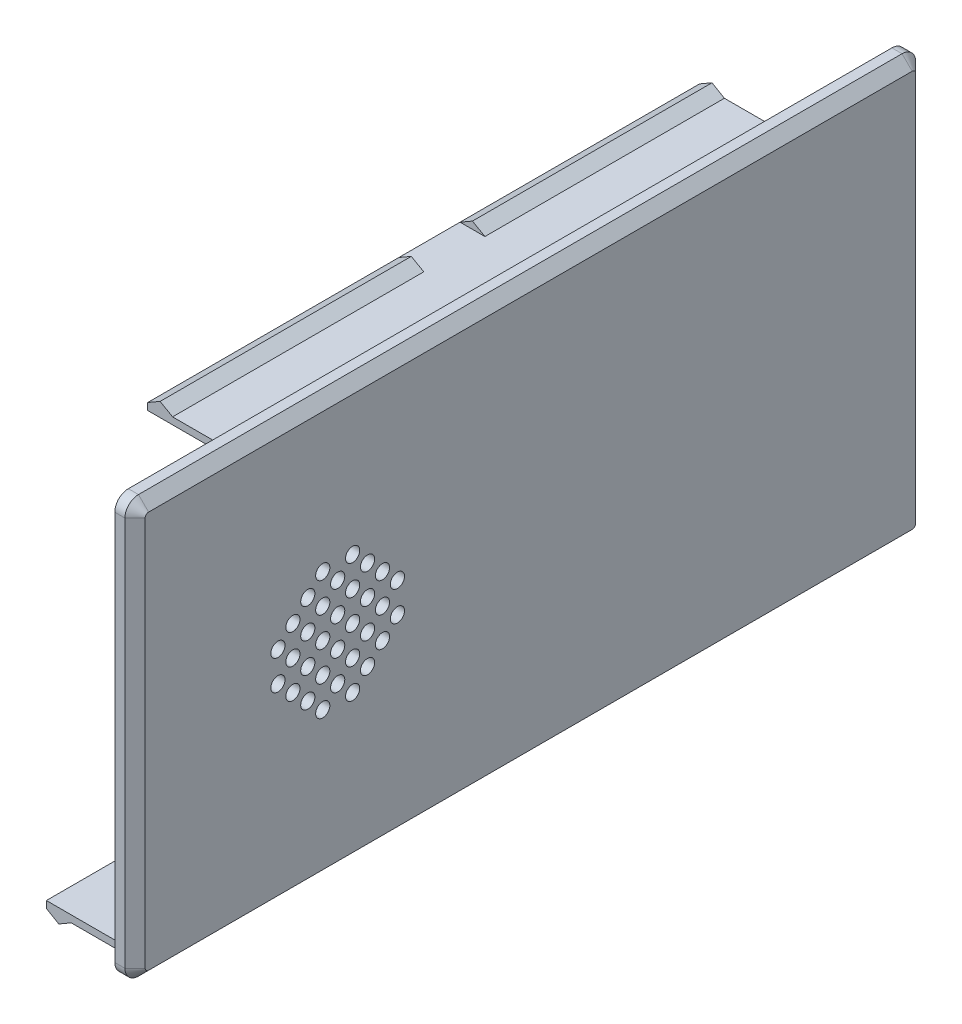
SolidWorks part; units mm, degrees
ref_plane "Front Plane" through (0, 0, 0) normal (0, 0, 1) x (1, 0, 0)
ref_plane "Top Plane" through (0, 0, 0) normal (0, 1, 0) x (1, 0, 0)
ref_plane "Right Plane" through (0, 0, 0) normal (1, 0, 0) x (0, 0, -1)
sketch "Sketch2" plane through (0, 0, 0) normal (1, 0, 0) x (0, 0, -1)
  line L0 (99.1126, 50.58) -> (99.1126, 1.7) construction
  line L1 (0, 0) -> (99.1126, 0)
  line L2 (0, 0) -> (0, 52.28)
  line L3 (0, 52.28) -> (99.1126, 52.28)
  line L4 (99.1126, 0) -> (99.1126, 52.28)
  line L5 (-67.31, 52.28) -> (97.4126, 52.28) construction
extrude "Boss-Extrude1" add sketch "Sketch2" along normal blind 2.54
sketch "Sketch3" plane through (0, 0, 0) normal (-1, 0, 0) x (0, 0, 1)
  line L0 (67.31, 50.58) -> (-97.4126, 50.58) construction
  line L1 (-1.42, 50.43) -> (-97.2626, 50.43)
  line L2 (-1.42, 50.43) -> (-1.42, 1.85)
  line L3 (-1.42, 1.85) -> (-97.2626, 1.85)
  line L4 (-97.2626, 50.43) -> (-97.2626, 1.85)
  line L5 (-97.4126, 1.7) -> (-1.27, 1.7) construction
  line L6 (-97.4126, 50.58) -> (-97.4126, 1.7) construction
  line L7 (-1.27, 1.7) -> (-1.27, 47.405) construction
  dimension "D1" = 0.15
  dimension "D2" = 0.15
  dimension "D3" = 0.15
  dimension "D4" = 0.15
extrude "Extrude-Thin1" add sketch "Sketch3" along normal blind 0.762 thin
sketch "Sketch4" plane through (0, 0, -1.42) normal (0, 0, 1) x (1, 0, 0)
  line L0 (-0.762, 50.43) -> (-6.8767, 50.43)
  line L1 (-6.8767, 50.43) -> (-8.4356, 51.33)
  line L2 (-8.4356, 51.33) -> (-9.9944, 50.43)
  line L3 (-9.9944, 50.43) -> (-9.9944, 49.56)
  line L4 (-9.9944, 49.56) -> (-0.762, 49.56)
  line L5 (-0.762, 1.85) -> (-0.762, 50.43) construction
  line L6 (-0.762, 49.56) -> (-0.762, 50.43)
  line L7 (-6.8767, 50.43) -> (-9.9944, 50.43) construction
  point P3 (-8.4356, 50.43)
  dimension "D1" = 6.1147
  dimension "D2" = 0.9
  dimension "D3" = 120
extrude "Boss-Extrude2" add sketch "Sketch4" against normal up to surface (95.8426 mm away)
ref_plane "Plane1" through (0, 26.14, 0) normal (0, 1, 0) x (1, 0, 0)
fillet "Fillet1" radius 1.7 4 edges at (1.27, 52.28, 0) (1.27, 0, 0) (1.27, 52.28, -99.1126) (1.27, 0, -99.1126)
sketch "Sketch5" plane through (0, 50.43, 0) normal (0, 1, 0) x (1, 0, 0)
  line L0 (-9.9944, 97.2626) -> (-9.9944, 1.42) construction
  line L1 (-9.9944, 45.6048) -> (-6.1087, 45.6048)
  line L2 (-9.9944, 45.6048) -> (-9.9944, 53.2701)
  line L3 (-9.9944, 53.2701) -> (-6.1087, 53.2701)
  line L4 (-6.1087, 45.6048) -> (-6.1087, 53.2701)
  line L5 (0, 99.1126) -> (2.54, 99.1126) construction
  dimension "D1" = 45.8425
  dimension "D2" = 7.6654
  dimension "D3" = 3.8857
extrude "Cut-Extrude1" cut sketch "Sketch5" along normal through all
mirror "Mirror3" about plane through (0, 26.14, 0) normal (0, 1, 0) of "Cut-Extrude1", "Boss-Extrude2"
sketch "Sketch6" plane through (0, 50.43, 0) normal (0, 1, 0) x (1, 0, 0)
  line L1 (-0.762, 83.2926) -> (-9.9944, 83.2926)
  line L2 (-0.762, 83.2926) -> (-0.762, 97.2626)
  line L3 (-0.762, 97.2626) -> (-9.9944, 97.2626)
  line L4 (-9.9944, 83.2926) -> (-9.9944, 97.2626)
  dimension "D1" = 13.97
extrude "Cut-Extrude2" cut sketch "Sketch6" against normal through all and the other way through all
chamfer "Chamfer1" distance 1.27 angle 45 8 edges at (2.54, 0, -49.5563) (2.54, 0.4979, -98.6147) (2.54, 0.4979, -0.4979) (2.54, 26.14, -99.1126) (2.54, 26.14, 0) (2.54, 51.7821, -98.6147) (2.54, 51.7821, -0.4979) (2.54, 52.28, -49.5563)
sketch "Sketch7" plane through (0, 50.43, 0) normal (0, 1, 0) x (1, 0, 0)
  line L0 (-6.8767, 1.42) -> (0, 1.42) construction
  line L1 (-0.762, 1.42) -> (-9.9944, 1.42)
  line L2 (-0.762, 1.42) -> (-0.762, 14.12)
  line L3 (-0.762, 14.12) -> (-9.9944, 14.12)
  line L4 (-9.9944, 1.42) -> (-9.9944, 14.12)
  line L5 (-9.9944, 45.6048) -> (-9.9944, 1.42) construction
  line L6 (-0.762, 2.29) -> (-0.762, 1.42) construction
  dimension "D1" = 12.7
extrude "Cut-Extrude3" cut sketch "Sketch7" against normal up to next and the other way up to next
sketch "Sketch8" plane through (2.54, 0, 0) normal (1, 0, 0) x (0, 0, -1)
  line L0 (0.6985, 26.14) -> (-0.6985, 26.14) construction
  line L1 (34.7621, 29.8848) -> (34.7621, 33.6297) construction
  line L2 (0, 1.7) -> (0, 50.58) construction
  line L3 (34.7621, 33.6297) -> (32.8897, 33.6297) construction
  line L4 (32.8897, 33.6297) -> (32.8897, 35.5021) construction
  line L5 (34.7621, 33.6297) -> (32.8897, 35.5021) construction
  line L6 (32.8897, 33.6297) -> (31.0173, 33.6297) construction
  line L7 (31.0173, 33.6297) -> (32.8897, 35.5021) construction
  line L8 (34.7621, 33.6297) -> (32.8897, 31.7573) construction
  line L9 (32.8897, 31.7573) -> (32.8897, 33.6297) construction
  line L10 (32.8897, 31.7573) -> (31.0173, 33.6297) construction
  line L15 (14.1655, 35.5021) -> (32.8897, 35.5021) construction
  circle A0 centre (25.4, 26.14) radius 9.525 construction
  circle A1 centre (32.8897, 35.5021) radius 0.889 construction
  circle A2 centre (34.7621, 33.6297) radius 0.889 construction
  circle A3 centre (31.0173, 33.6297) radius 0.889 construction
  circle A4 centre (32.8897, 31.7573) radius 0.889 construction
  circle A5 centre (29.1448, 35.5021) radius 0.889 construction
  circle A6 centre (31.0173, 33.6297) radius 0.889 construction
  circle A7 centre (25.4, 35.5021) radius 0.889 construction
  circle A8 centre (27.2724, 33.6297) radius 0.889
  circle A9 centre (21.6552, 35.5021) radius 0.889 construction
  circle A10 centre (23.5276, 33.6297) radius 0.889
  circle A11 centre (17.9103, 35.5021) radius 0.889 construction
  circle A12 centre (19.7827, 33.6297) radius 0.889 construction
  circle A13 centre (14.1655, 35.5021) radius 0.889 construction
  circle A14 centre (16.0379, 33.6297) radius 0.889 construction
  circle A17 centre (29.1448, 31.7573) radius 0.889
  circle A18 centre (31.0173, 29.8848) radius 0.889
  circle A19 centre (25.4, 31.7573) radius 0.889
  circle A20 centre (27.2724, 29.8848) radius 0.889
  circle A21 centre (21.6552, 31.7573) radius 0.889
  circle A22 centre (23.5276, 29.8848) radius 0.889
  circle A23 centre (17.9103, 31.7573) radius 0.889 construction
  circle A24 centre (19.7827, 29.8848) radius 0.889
  circle A25 centre (14.1655, 31.7573) radius 0.889 construction
  circle A26 centre (16.0379, 29.8848) radius 0.889 construction
  circle A29 centre (29.1448, 28.0124) radius 0.889
  circle A30 centre (31.0173, 26.14) radius 0.889
  circle A31 centre (25.4, 28.0124) radius 0.889
  circle A32 centre (27.2724, 26.14) radius 0.889
  circle A33 centre (21.6552, 28.0124) radius 0.889
  circle A34 centre (23.5276, 26.14) radius 0.889
  circle A35 centre (17.9103, 28.0124) radius 0.889
  circle A36 centre (19.7827, 26.14) radius 0.889
  circle A37 centre (14.1655, 28.0124) radius 0.889 construction
  circle A38 centre (16.0379, 26.14) radius 0.889 construction
  circle A41 centre (29.1448, 24.2676) radius 0.889
  circle A42 centre (31.0173, 22.3952) radius 0.889
  circle A43 centre (25.4, 24.2676) radius 0.889
  circle A44 centre (27.2724, 22.3952) radius 0.889
  circle A45 centre (21.6552, 24.2676) radius 0.889
  circle A46 centre (23.5276, 22.3952) radius 0.889
  circle A47 centre (17.9103, 24.2676) radius 0.889
  circle A48 centre (19.7827, 22.3952) radius 0.889
  circle A49 centre (14.1655, 24.2676) radius 0.889 construction
  circle A50 centre (16.0379, 22.3952) radius 0.889 construction
  circle A53 centre (29.1448, 20.5227) radius 0.889
  circle A54 centre (31.0173, 18.6503) radius 0.889 construction
  circle A55 centre (25.4, 20.5227) radius 0.889
  circle A56 centre (27.2724, 18.6503) radius 0.889
  circle A57 centre (21.6552, 20.5227) radius 0.889
  circle A58 centre (23.5276, 18.6503) radius 0.889
  circle A59 centre (17.9103, 20.5227) radius 0.889 construction
  circle A60 centre (19.7827, 18.6503) radius 0.889 construction
  circle A61 centre (14.1655, 20.5227) radius 0.889 construction
  circle A62 centre (16.0379, 18.6503) radius 0.889 construction
  circle A65 centre (29.1448, 16.7779) radius 0.889 construction
  circle A66 centre (31.0173, 14.9055) radius 0.889 construction
  circle A67 centre (25.4, 16.7779) radius 0.889 construction
  circle A68 centre (27.2724, 14.9055) radius 0.889 construction
  circle A69 centre (21.6552, 16.7779) radius 0.889 construction
  circle A70 centre (23.5276, 14.9055) radius 0.889 construction
  circle A71 centre (17.9103, 16.7779) radius 0.889 construction
  circle A72 centre (19.7827, 14.9055) radius 0.889 construction
  circle A73 centre (14.1655, 16.7779) radius 0.889 construction
  circle A74 centre (16.0379, 14.9055) radius 0.889 construction
  circle A89 centre (32.8897, 31.7573) radius 0.889 construction
  circle A90 centre (34.7621, 29.8848) radius 0.889 construction
  circle A91 centre (32.8897, 28.0124) radius 0.889
  circle A92 centre (34.7621, 26.14) radius 0.889 construction
  circle A93 centre (32.8897, 24.2676) radius 0.889
  circle A94 centre (34.7621, 22.3952) radius 0.889 construction
  circle A95 centre (32.8897, 20.5227) radius 0.889 construction
  circle A96 centre (34.7621, 18.6503) radius 0.889 construction
  circle A97 centre (32.8897, 16.7779) radius 0.889 construction
  circle A98 centre (34.7621, 14.9055) radius 0.889 construction
  point P10 (33.5183, 34.8735)
  point P12 (34.1335, 34.2583)
  point P20 (25.4, 26.14)
  dimension "D1" = 25.4
  dimension "D3" = 1.778
  dimension "D4" = 6
  dimension "D2" = 19.05
  dimension "D5" = 0.87
  dimension "D6" = 6
extrude "Cut-Extrude5" cut sketch "Sketch8" against normal up to next (2.54 mm away)
